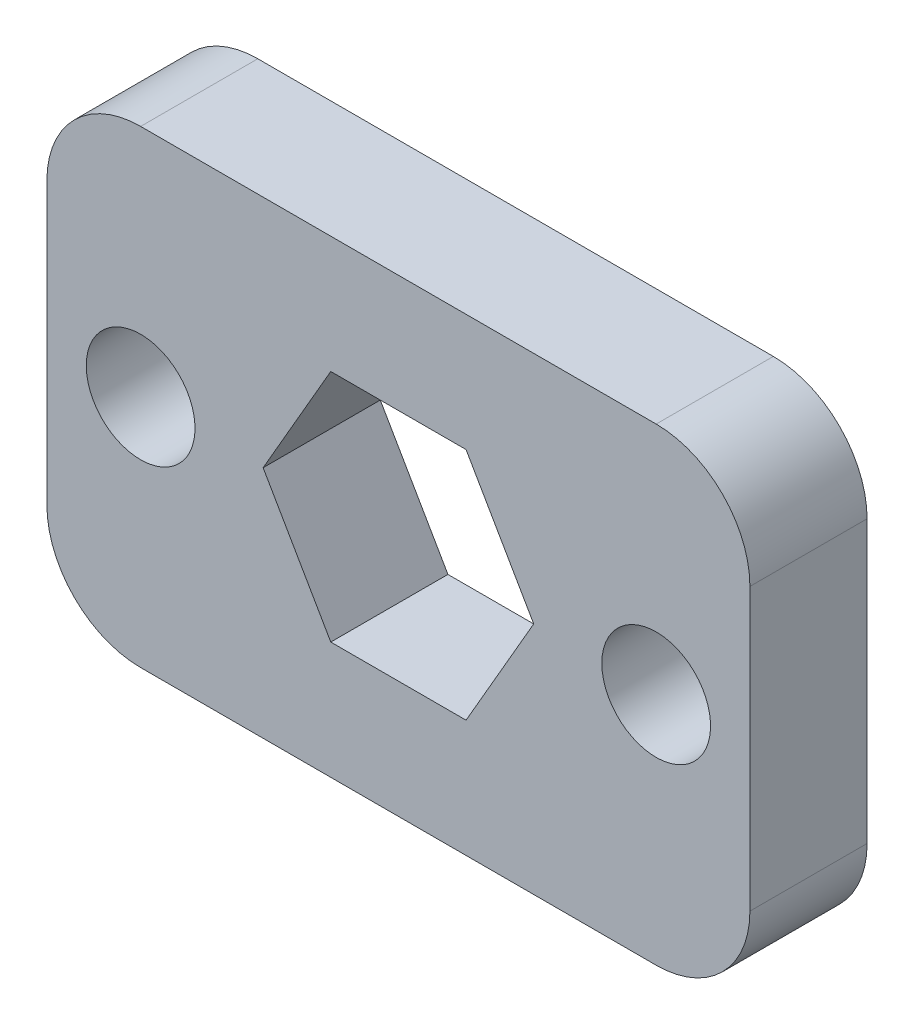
SolidWorks part; units mm, degrees
ref_plane "Front Plane" through (0, 0, 0) normal (0, 0, 1) x (1, 0, 0)
ref_plane "Top Plane" through (0, 0, 0) normal (0, 1, 0) x (1, 0, 0)
ref_plane "Right Plane" through (0, 0, 0) normal (1, 0, 0) x (0, 0, -1)
sketch "Sketch1" plane through (0, 0, 0) normal (0, 0, -1) x (-1, 0, 0)
  line L1 (0, 0) -> (19.05, 0)
  line L2 (0, 0) -> (0, 12.7)
  line L3 (0, 12.7) -> (19.05, 12.7)
  line L4 (19.05, 0) -> (19.05, 12.7)
  line L5 (13.1912, 6.35) -> (11.3581, 9.525)
  line L6 (11.3581, 9.525) -> (7.6919, 9.525)
  line L7 (7.6919, 9.525) -> (5.8588, 6.35)
  line L8 (5.8588, 6.35) -> (7.6919, 3.175)
  line L9 (7.6919, 3.175) -> (11.3581, 3.175)
  line L10 (11.3581, 3.175) -> (13.1912, 6.35)
  circle A1 centre (9.525, 6.35) radius 3.175 construction
  point P5 (9.525, 12.7)
  point P8 (0, 6.35)
  dimension "D4" = 6.35
  dimension "D3" = 19.05
  dimension "D5" = 12.7
  dimension "D7" = 7.3323
extrude "Boss-Extrude1" add sketch "Sketch1" along normal blind 3.175
hole_wizard "#4 Clearance Hole1" positions "Sketch3" profile "Sketch2" hole size "#4" standard "ANSI Inch"
sketch "Sketch3" plane through (0, 0, -3.175) normal (0, 0, -1) x (-1, 0, 0)
  line L2 (9.525, 12.7) -> (9.525, 0) construction
  line L3 (19.05, 12.7) -> (0, 12.7) construction
  line L4 (0, 0) -> (19.05, 0) construction
  point P5 (2.54, 6.35)
  point P23 (16.51, 6.35)
  dimension "D1" = 6.985
sketch "Sketch2" plane through (-2.54, 6.35, -3.175) normal (1, 0, 0) x (0, 1, 0)
  line L0 (0, 0) -> (0, 3.175)
  line L1 (0, 3.175) -> (1.4732, 3.175)
  line L2 (1.4732, 3.175) -> (1.4732, 0)
  line L5 (1.4732, 0) -> (0, 0)
  line L11 (0, -6.35) -> (0, 107.95) construction
  dimension "Thru Hole Dia." = 2.9464
  dimension "Thru Hole Depth" = 3.175
fillet "Fillet1" radius 2.54 4 edges at (-19.05, 0, -1.5875) (0, 0, -1.5875) (-19.05, 12.7, -1.5875) (0, 12.7, -1.5875)
sketch "Sketch4" plane through (0, 0, 0) normal (0, 0, 1) x (1, 0, 0)
  line L0 (-11.5593, 12.0974) -> (-11.5593, 0.6026) construction
  line L1 (-11.5593, 12.0974) -> (-17.2134, 17.2058)
  line L2 (-17.2134, -4.5058) -> (-11.5593, 0.6026)
  line L3 (-11.5593, 12.0974) -> (-15.9376, 9.2069)
  line L4 (-15.9376, 3.4931) -> (-11.5593, 0.6026)
  line L5 (-14.9649, 8.328) -> (-15.9376, 9.2069) construction
  line L6 (-15.9376, 3.4931) -> (-14.9649, 4.372) construction
  arc A0 (-15.9376, 9.2069) -> (-15.9376, 3.4931) centre (-5.198, 6.35) ccw
  arc A1 (-17.2134, 17.2058) -> (-17.2134, -4.5058) centre (-5.198, 6.35) ccw
  point P2 (-11.5593, 6.35)
  dimension "D2" = 7.62
  dimension "D1" = 5.08
extrude "Boss-Extrude2" [suppressed] add sketch "Sketch4" against normal blind 3.175
